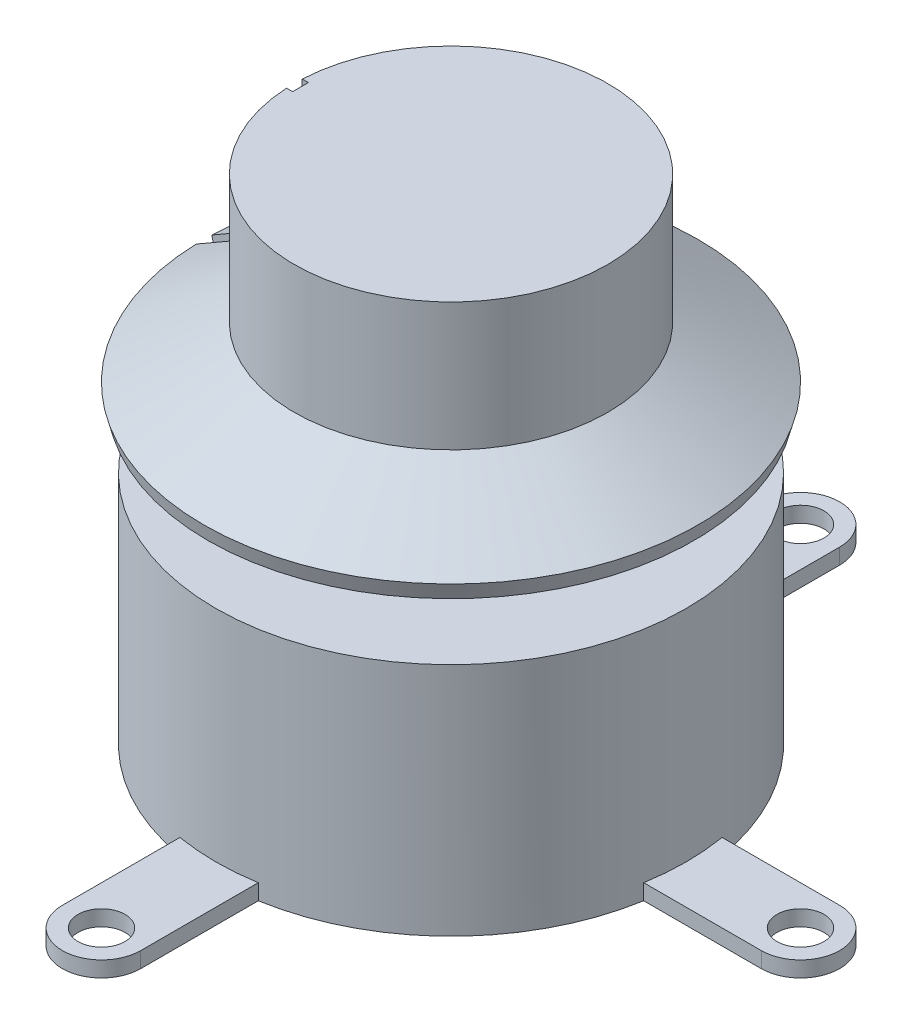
SolidWorks part; units mm, degrees
ref_plane "Plane1" through (0, 0, 0) normal (0, 0, 1) x (1, 0, 0)
ref_plane "Plane2" through (0, 0, 0) normal (0, 1, 0) x (1, 0, 0)
ref_plane "Plane3" through (0, 0, 0) normal (1, 0, 0) x (0, 0, -1)
sketch "Sketch1" plane through (0, 0, 0) normal (0, 1, 0) x (1, 0, 0)
  circle A0 centre (0, 0) radius 19.05
  dimension "D1" = 38.1
extrude "Extrude1" add sketch "Sketch1" along normal blind 19.05
sketch "Sketch2" plane through (0, 0, 0) normal (0, -1, 0) x (1, 0, 0)
  line L0 (50, 0) -> (-50, 0) construction
  line L1 (0, -50) -> (0, 50) construction
  line L2 (3.175, 28.3086) -> (3.175, 18.7836)
  line L3 (3.175, 18.7836) -> (-3.175, 18.7836)
  line L4 (-3.175, 28.3086) -> (-3.175, 18.7836)
  line L5 (18.7836, 3.175) -> (28.3086, 3.175)
  line L6 (18.7836, 3.175) -> (18.7836, -3.175)
  line L7 (18.7836, -3.175) -> (28.3086, -3.175)
  line L8 (-5.9727, 0) -> (5.8903, 0) construction
  line L9 (-3.175, -28.3086) -> (-3.175, -18.7836)
  line L10 (3.175, -18.7836) -> (-3.175, -18.7836)
  line L11 (3.175, -28.3086) -> (3.175, -18.7836)
  arc A0 (3.175, 28.3086) -> (-3.175, 28.3086) centre (0, 28.3086) ccw
  arc A1 (28.3086, 3.175) -> (28.3086, -3.175) centre (28.3086, 0) cw
  circle A2 centre (0, 28.3086) radius 1.905
  circle A3 centre (28.3086, 0) radius 1.905
  circle A4 centre (0, -28.3086) radius 1.905
  arc A5 (3.175, -28.3086) -> (-3.175, -28.3086) centre (0, -28.3086) cw
  circle A6 centre (0, 0) radius 19.05 construction
  dimension "D3" = 3.81
  dimension "D1" = 9.525
  dimension "D2" = 6.35
extrude "Extrude2" add sketch "Sketch2" against normal blind 1.27
sketch "Sketch3" plane through (0, 0, 0) normal (0, -1, 0) x (1, 0, 0)
  text T0 "G" font "Arial Black" height 3.175
  text T1 "C" font "Arial Black" height 3.175
  text T2 "out" font "Arial Black" height 3.175
extrude "Cut-Extrude1" cut sketch "Sketch3" against normal blind 0.254
sketch "Sketch4" plane through (0, 19.05, 0) normal (0, 1, 0) x (-1, 0, 0)
  circle A0 centre (0, 0) radius 3.048
  dimension "D1" = 6.096
extrude "Extrude3" add sketch "Sketch4" along normal blind 19.05
sketch "Sketch5" plane through (0, 0, 0) normal (0, 0, 1) x (1, 0, 0)
  line L0 (0, 40.005) -> (0, 15.1107) construction
  line L1 (0, 38.1) -> (0, 19.05) construction
  line L2 (0, 1.27) -> (0, 0) construction
  line L3 (0, 40.005) -> (-12.7, 40.005)
  line L4 (-12.7, 40.005) -> (-12.7, 29.6293)
  line L5 (-12.7, 29.6293) -> (-20.0253, 25.4)
  line L6 (-19.685, 24.13) -> (0, 24.13)
  line L7 (0, 24.13) -> (0, 40.005)
  line L8 (19.05, 19.05) -> (-19.05, 19.05) construction
  line L9 (-20.0253, 25.4) -> (-19.685, 24.13)
  point P8 (-22.225, 24.13)
  dimension "D1" = 25.4
  dimension "D2" = 44.45
  dimension "D3" = 15.875
  dimension "D4" = 5.08
  dimension "D5" = 30
revolve "Revolve1" add sketch "Sketch5" angle 360 about L0
sketch "Sketch6" plane through (0, 0, 0) normal (0, 0, 1) x (1, 0, 0)
  line L2 (-12.7, 40.005) -> (-12.7, 29.6293) construction
  line L3 (-12.7, 29.6293) -> (-20.0253, 25.4) construction
  line L4 (-12.192, 29.336) -> (-19.7713, 24.9601)
  line L5 (-12.192, 40.005) -> (-12.192, 29.336)
  line L6 (-12.192, 29.336) -> (-19.8892, 24.892)
  line L7 (-12.192, 40.005) -> (-12.192, 29.336)
  line L8 (12.7, 40.005) -> (-12.7, 40.005) construction
  line L9 (-20.0253, 25.4) -> (-19.685, 24.13) construction
  line L10 (-12.192, 40.005) -> (-12.7, 40.005)
  line L11 (-20.0253, 25.4) -> (-19.8892, 24.892)
  line L12 (-12.7, 29.6293) -> (-20.0253, 25.4)
  line L13 (-12.7, 40.005) -> (-12.7, 29.6293)
  dimension "D1" = 0.508
extrude "Cut-Extrude2" cut sketch "Sketch6" against normal mid plane 1.27
